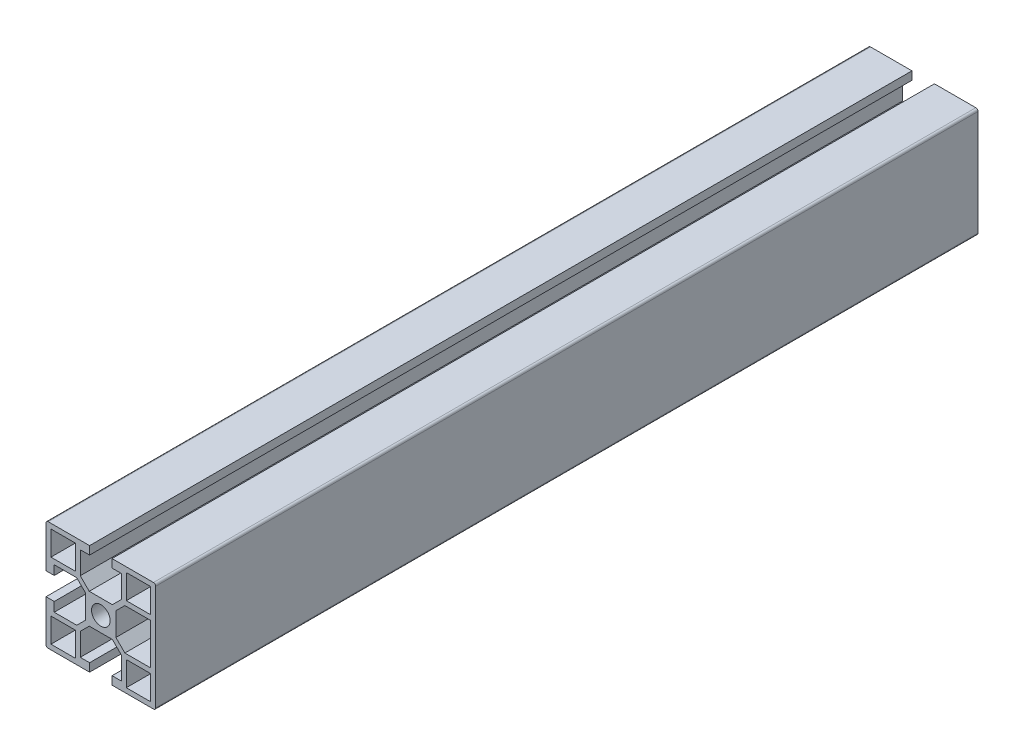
SolidWorks part; units mm, degrees
ref_plane "前视基准面" through (0, 0, 0) normal (0, 0, 1) x (1, 0, 0)
ref_plane "上视基准面" through (0, 0, 0) normal (0, 1, 0) x (1, 0, 0)
ref_plane "右视基准面" through (0, 0, 0) normal (1, 0, 0) x (0, 0, -1)
sketch "Model" plane through (0, 0, 0) normal (0, 0, 1) x (1, 0, 0)
  line L0 (7974.7422, 2622.5936) -> (7974.7422, 2637.5936)
  line L1 (7974.7422, 2637.5936) -> (7965.315, 2637.5936)
  line L2 (7965.315, 2637.5936) -> (7962.0422, 2634.3208)
  line L3 (7962.0422, 2634.3208) -> (7962.0422, 2625.8664)
  line L4 (7962.0422, 2625.8664) -> (7965.315, 2622.5936)
  line L5 (7965.315, 2622.5936) -> (7974.7422, 2622.5936)
  line L6 (7974.7422, 2648.2936) -> (7965.8422, 2648.2936)
  line L7 (7965.8422, 2648.2936) -> (7965.8422, 2639.3936)
  line L8 (7965.8422, 2639.3936) -> (7974.7422, 2639.3936)
  line L9 (7974.7422, 2639.3936) -> (7974.7422, 2648.2936)
  line L10 (7965.8422, 2611.8936) -> (7974.7422, 2611.8936)
  line L11 (7974.7422, 2611.8936) -> (7974.7422, 2620.7936)
  line L12 (7974.7422, 2620.7936) -> (7965.8422, 2620.7936)
  line L13 (7965.8422, 2620.7936) -> (7965.8422, 2611.8936)
  line L14 (7938.3422, 2611.8936) -> (7947.2422, 2611.8936)
  line L15 (7947.2422, 2611.8936) -> (7947.2422, 2620.7936)
  line L16 (7947.2422, 2620.7936) -> (7938.3422, 2620.7936)
  line L17 (7938.3422, 2620.7936) -> (7938.3422, 2611.8936)
  line L18 (7947.2422, 2648.2936) -> (7938.3422, 2648.2936)
  line L19 (7938.3422, 2648.2936) -> (7938.3422, 2639.3936)
  line L20 (7938.3422, 2639.3936) -> (7947.2422, 2639.3936)
  line L21 (7947.2422, 2639.3936) -> (7947.2422, 2648.2936)
  line L22 (7976.5422, 2610.8936) -> (7976.5422, 2649.2936)
  line L23 (7975.7422, 2610.0936) -> (7960.6422, 2610.0936)
  line L24 (7960.6422, 2613.0936) -> (7960.6422, 2610.0936)
  line L25 (7964.0422, 2613.0936) -> (7960.6422, 2613.0936)
  line L26 (7964.0422, 2613.0936) -> (7964.0422, 2621.3208)
  line L27 (7960.7694, 2624.5936) -> (7964.0422, 2621.3208)
  line L28 (7960.7694, 2624.5936) -> (7952.315, 2624.5936)
  line L29 (7952.315, 2624.5936) -> (7949.0422, 2621.3208)
  line L30 (7949.0422, 2613.0936) -> (7949.0422, 2621.3208)
  line L31 (7949.0422, 2613.0936) -> (7952.4422, 2613.0936)
  line L32 (7952.4422, 2613.0936) -> (7952.4422, 2610.0936)
  line L33 (7937.3422, 2610.0936) -> (7952.4422, 2610.0936)
  line L34 (7936.5422, 2625.9936) -> (7936.5422, 2610.8936)
  line L35 (7936.5422, 2625.9936) -> (7939.5422, 2625.9936)
  line L36 (7939.5422, 2625.9936) -> (7939.5422, 2622.5936)
  line L37 (7939.5422, 2622.5936) -> (7947.7694, 2622.5936)
  line L38 (7951.0422, 2625.8664) -> (7947.7694, 2622.5936)
  line L39 (7951.0422, 2625.8664) -> (7951.0422, 2634.3208)
  line L40 (7951.0422, 2634.3208) -> (7947.7694, 2637.5936)
  line L41 (7939.5422, 2637.5936) -> (7947.7694, 2637.5936)
  line L42 (7939.5422, 2634.1936) -> (7939.5422, 2637.5936)
  line L43 (7936.5422, 2634.1936) -> (7939.5422, 2634.1936)
  line L44 (7936.5422, 2634.1936) -> (7936.5422, 2649.2936)
  line L45 (7937.3422, 2650.0936) -> (7952.4422, 2650.0936)
  line L46 (7952.4422, 2647.0936) -> (7952.4422, 2650.0936)
  line L47 (7949.0422, 2647.0936) -> (7952.4422, 2647.0936)
  line L48 (7949.0422, 2647.0936) -> (7949.0422, 2638.8664)
  line L49 (7952.315, 2635.5936) -> (7949.0422, 2638.8664)
  line L50 (7960.7694, 2635.5936) -> (7952.315, 2635.5936)
  line L51 (7960.7694, 2635.5936) -> (7964.0422, 2638.8664)
  line L52 (7964.0422, 2647.0936) -> (7964.0422, 2638.8664)
  line L53 (7964.0422, 2647.0936) -> (7960.6422, 2647.0936)
  line L54 (7960.6422, 2647.0936) -> (7960.6422, 2650.0936)
  line L55 (7975.7422, 2650.0936) -> (7960.6422, 2650.0936)
  circle A0 centre (7956.5422, 2630.0936) radius 3.4
  arc A1 (7976.5422, 2649.2936) -> (7975.7422, 2650.0936) centre (7975.7422, 2649.2936) ccw
  arc A2 (7975.7422, 2610.0936) -> (7976.5422, 2610.8936) centre (7975.7422, 2610.8936) ccw
  arc A3 (7936.5422, 2610.8936) -> (7937.3422, 2610.0936) centre (7937.3422, 2610.8936) ccw
  arc A4 (7937.3422, 2650.0936) -> (7936.5422, 2649.2936) centre (7937.3422, 2649.2936) ccw
extrude "凸台-拉伸1" add sketch "Model" along normal blind 300
